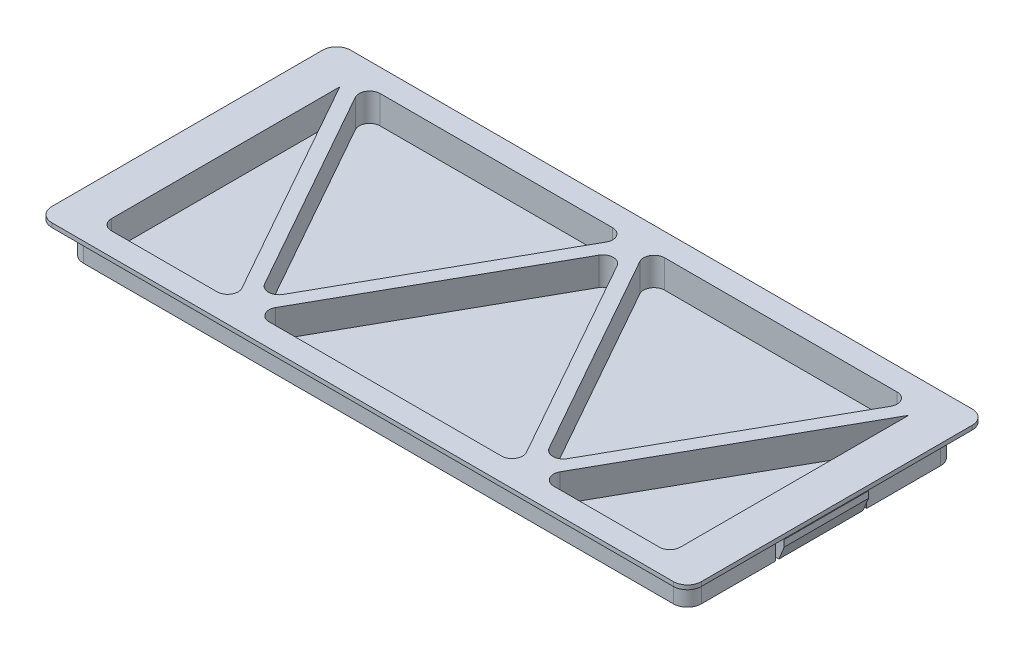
SolidWorks part; units mm, degrees
ref_plane "Front Plane" through (0, 0, 0) normal (0, 0, 1) x (1, 0, 0)
ref_plane "Top Plane" through (0, 0, 0) normal (0, 1, 0) x (1, 0, 0)
ref_plane "Right Plane" through (0, 0, 0) normal (1, 0, 0) x (0, 0, -1)
sketch "Sketch1" plane through (0, 0, 0) normal (0, 1, 0) x (1, 0, 0)
  line L1 (44.05, -19.05) -> (-44.05, -19.05)
  line L2 (44.05, -19.05) -> (44.05, 19.05)
  line L3 (44.05, 19.05) -> (-44.05, 19.05)
  line L4 (-44.05, -19.05) -> (-44.05, 19.05)
  line L5 (44.05, -19.05) -> (-44.05, 19.05) construction
  line L6 (44.05, 19.05) -> (-44.05, -19.05) construction
  point P0 (0, 0)
  dimension "D1" = 88.1
  dimension "D2" = 38.1
extrude "Boss-Extrude1" add sketch "Sketch1" along normal blind 5
shell "Shell1" thickness 1
sketch "Sketch2" plane through (0, 5, 0) normal (0, 1, 0) x (1, 0, 0)
  line L0 (-46.3, 21.3) -> (-46.3, -21.3)
  line L1 (-46.3, -21.3) -> (46.3, -21.3)
  line L2 (46.3, -21.3) -> (46.3, 21.3)
  line L3 (46.3, 21.3) -> (-46.3, 21.3)
  line L4 (-44.05, 19.05) -> (-44.05, -19.05)
  line L5 (-44.05, -19.05) -> (44.05, -19.05)
  line L6 (44.05, -19.05) -> (44.05, 19.05)
  line L7 (44.05, 19.05) -> (-44.05, 19.05)
  line L8 (-44.05, 19.05) -> (-44.05, -19.05)
  line L9 (-44.05, -19.05) -> (44.05, -19.05)
  line L10 (44.05, -19.05) -> (44.05, 19.05)
  line L11 (44.05, 19.05) -> (-44.05, 19.05)
  dimension "D1" = 0
  dimension "D2" = 2.25
extrude "Boss-Extrude2" add sketch "Sketch2" against normal blind 0.6
sketch "Sketch5" plane through (0, 0, 0) normal (0, -1, 0) x (1, 0, 0)
  line L0 (44.05, 19.05) -> (44.05, -19.05) construction
  line L1 (44.05, 19.05) -> (40.55, 19.05)
  line L2 (44.05, 19.05) -> (44.05, -19.05)
  line L3 (44.05, -19.05) -> (40.55, -19.05)
  line L4 (40.55, 19.05) -> (40.55, -19.05)
  line L5 (44.05, 6.5) -> (42.55, 6.5) construction
  line L6 (42.55, 6.5) -> (42.55, -6.5) construction
  line L7 (42.55, -6.5) -> (44.05, -6.5) construction
  point P6 (40.55, 0)
  point P12 (42.55, 0)
  dimension "D1" = 2
  dimension "D3" = 1.5
  dimension "D4" = 13
extrude "Boss-Extrude4" add sketch "Sketch5" against normal up to surface (5 mm away)
sketch "Sketch7" plane through (0, 0, 0) normal (0, -1, 0) x (1, 0, 0)
  line L1 (42.55, 6.5) -> (44.05, 6.5)
  line L2 (42.55, 6.5) -> (42.55, -6.5)
  line L3 (42.55, -6.5) -> (44.05, -6.5)
  line L4 (44.05, 6.5) -> (44.05, -6.5)
extrude "Cut-Extrude2" cut sketch "Sketch7" against normal offset from surface (3.9 mm away) 0.5
sketch "Sketch8" plane through (0, 3.9, 0) normal (0, -1, 0) x (1, 0, 0)
  line L0 (44.05, -6.5) -> (44.05, 6.5) construction
  line L1 (44.05, 6) -> (43.55, 6)
  line L2 (44.05, 6) -> (44.05, -6)
  line L3 (44.05, -6) -> (43.55, -6)
  line L4 (43.55, 6) -> (43.55, -6)
  line L5 (44.05, 6.5) -> (42.55, 6.5) construction
  line L6 (42.55, 6.5) -> (42.55, -6.5) construction
  point P10 (43.55, 0)
  dimension "D1" = 1
  dimension "D2" = 0.5
extrude "Boss-Extrude5" add sketch "Sketch8" along normal up to surface (3.9 mm away)
sketch "Sketch9" plane through (0, 0, -6) normal (0, 0, -1) x (-1, 0, 0)
  line L0 (-46.3, 4.4) -> (46.3, 4.4) construction
  line L1 (-44.05, 0) -> (-44.8, 1.8563)
  line L2 (-44.05, 0) -> (-44.05, 2.8)
  line L3 (-44.05, 2.8) -> (-44.8, 2.8)
  line L4 (-44.8, 1.8563) -> (-44.8, 2.8)
  dimension "D1" = 0.75
  dimension "D2" = 1.6
  dimension "D3" = 22
extrude "Boss-Extrude6" add sketch "Sketch9" against normal up to surface (12 mm away)
mirror "Mirror1" about plane through (0, 0, 0) normal (1, 0, 0) of "Boss-Extrude4", "Cut-Extrude2", "Boss-Extrude5", "Boss-Extrude6"
sketch "Sketch3" plane through (0, 5, 0) normal (0, 1, 0) x (1, 0, 0)
  line L0 (-40.55, 18.05) -> (-20.275, -18.05) construction
  line L1 (-40.55, -18.05) -> (40.55, -18.05) construction
  line L2 (-20.275, -18.05) -> (0, 18.05) construction
  line L3 (40.55, 18.05) -> (-40.55, 18.05) construction
  line L4 (0, 18.05) -> (20.275, -18.05) construction
  line L5 (20.275, -18.05) -> (40.55, 18.05) construction
  line L6 (-41.4219, 17.5603) -> (-20.275, -20.0921)
  line L7 (-20.275, -20.0921) -> (0, 16.0079)
  line L8 (0, 16.0079) -> (20.275, -20.0921)
  line L9 (20.275, -20.0921) -> (41.4219, 17.5603)
  line L10 (-39.6781, 18.5397) -> (-20.275, -16.0079)
  line L11 (-20.275, -16.0079) -> (0, 20.0921)
  line L12 (0, 20.0921) -> (20.275, -16.0079)
  line L13 (20.275, -16.0079) -> (39.6781, 18.5397)
  line L14 (-41.4219, 17.5603) -> (-39.6781, 18.5397)
  line L15 (41.4219, 17.5603) -> (39.6781, 18.5397)
  line L16 (-40.55, 18.05) -> (-20.275, -18.05) construction
  line L17 (20.275, -18.05) -> (40.55, 18.05) construction
  line L18 (40.55, 18.05) -> (-40.55, 18.05) construction
  line L19 (40.55, -18.05) -> (40.55, 18.05) construction
  line L20 (-40.55, 18.05) -> (-40.55, -18.05) construction
  line L21 (-40.55, -18.05) -> (-40.55, 18.05) construction
  dimension "D1" = 1
  dimension "D2" = 1
extrude "Boss-Extrude3" add sketch "Sketch3" against normal up to surface (4 mm away)
sketch "Sketch4" plane through (0, 0, 0) normal (0, -1, 0) x (1, 0, 0)
  line L9 (-44.05, 19.05) -> (44.05, 19.05)
  line L10 (-44.05, 19.05) -> (-44.05, 119.05)
  line L11 (-44.05, 119.05) -> (44.05, 119.05)
  line L12 (44.05, 19.05) -> (44.05, 119.05)
  line L13 (44.05, -19.05) -> (-44.05, -19.05)
  line L14 (44.05, -19.05) -> (44.05, -119.05)
  line L15 (44.05, -119.05) -> (-44.05, -119.05)
  line L16 (-44.05, -19.05) -> (-44.05, -119.05)
  dimension "D1" = 100
  dimension "D2" = 100
extrude "Cut-Extrude1" cut sketch "Sketch4" against normal up to surface (4.4 mm away)
fillet "Fillet1" radius 2 8 edges at (-46.3, 4.7, 21.3) (-44.05, 2.2, 19.05) (-44.05, 2.2, -19.05) (44.05, 2.2, 19.05) (46.3, 4.7, 21.3) (44.05, 2.2, -19.05) (46.3, 4.7, -21.3) (-46.3, 4.7, -21.3)
fillet "Fillet2" radius 1.5 13 edges at (39.4031, 3, -18.05) (20.275, 3, 16.0079) (21.4219, 3, 18.05) (19.1281, 3, 18.05) (0, 3, -16.0079) (1.1469, 3, -18.05) (-1.1469, 3, -18.05) (-19.1281, 3, 18.05) (-21.4219, 3, 18.05) (-20.275, 3, 16.0079) (-39.4031, 3, -18.05) (40.55, 3, 18.05) (-40.55, 3, 18.05)
